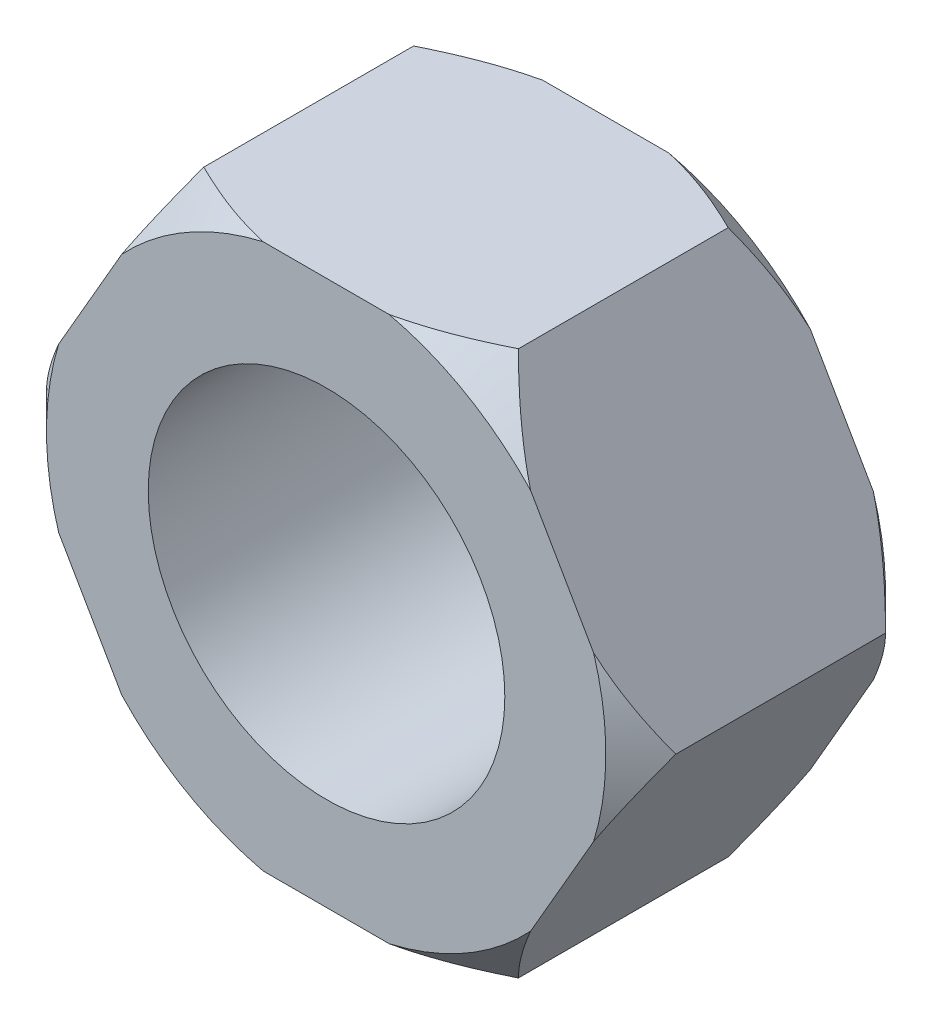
SolidWorks part; units mm, degrees
ref_plane "Face" through (0, 0, 0) normal (0, 0, 1) x (1, 0, 0)
ref_plane "Dessus" through (0, 0, 0) normal (0, 1, 0) x (1, 0, 0)
ref_plane "Droite" through (0, 0, 0) normal (1, 0, 0) x (0, 0, -1)
sketch "Esquisse1" plane through (0, 0, 0) normal (0, 0, 1) x (1, 0, 0)
  circle A0 centre (0, 0) radius 9
  dimension "D1" = 18
extrude "Extrusion1" add sketch "Esquisse1" along normal blind 8
hole_wizard "Trou taraudé M121" positions "Esquisse3" profile "Esquisse2" tap size "M12" standard "ISO"
sketch "Esquisse3" plane through (0, 0, 8) normal (0, 0, 1) x (1, 0, 0)
  point P0 (0.0105, -0.0209)
sketch "Esquisse2" plane through (0.0105, -0.0209, 8) normal (1, 0, 0) x (0, -1, 0)
  line L0 (0, 0) -> (0, 8)
  line L1 (0, 8) -> (5.1, 8)
  line L2 (5.1, 8) -> (5.1, 0)
  line L5 (5.1, 0) -> (0, 0)
  line L11 (0, -6.35) -> (0, 107.95) construction
  dimension "Diamètre du trou pour taraudage jusqu'au prochain" = 10.2
  dimension "Profondeur du trou pour taraudage jusqu'au prochain" = 8
chamfer "Chanfrein1" distance 1 angle 45 2 edges at (9, 0, 0) (9, 0, 8)
sketch "Esquisse4" plane through (0, 0, 8) normal (0, 0, 1) x (1, 0, 0)
  line L1 (9, 0) -> (4.5, 7.7942)
  line L2 (4.5, 7.7942) -> (-4.5, 7.7942)
  line L3 (-4.5, 7.7942) -> (-9, 0)
  line L4 (-9, 0) -> (-4.5, -7.7942)
  line L5 (-4.5, -7.7942) -> (4.5, -7.7942)
  line L6 (4.5, -7.7942) -> (9, 0)
  circle A0 centre (0, 0) radius 7.7942 construction
  circle A1 centre (0, 0) radius 9 construction
extrude "Enlèv. mat.-Extru.1" cut sketch "Esquisse4" against normal blind 10 flip side to cut
